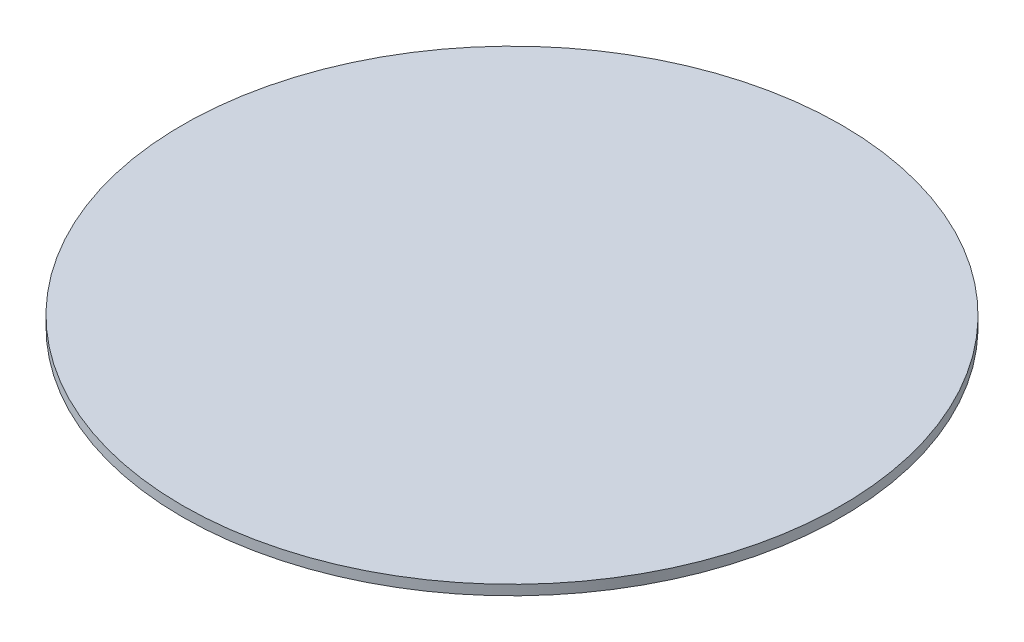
SolidWorks part; units mm, degrees
ref_plane "Front Plane" through (0, 0, 0) normal (0, 0, 1) x (1, 0, 0)
ref_plane "Top Plane" through (0, 0, 0) normal (0, 1, 0) x (1, 0, 0)
ref_plane "Right Plane" through (0, 0, 0) normal (1, 0, 0) x (0, 0, -1)
sketch "Sketch1" plane through (0, 0, 0) normal (0, 1, 0) x (1, 0, 0)
  circle A0 centre (0, 0) radius 838.2
  dimension "D1" = 1676.4
extrude "Extrude1" add sketch "Sketch1" along normal blind 25.4
